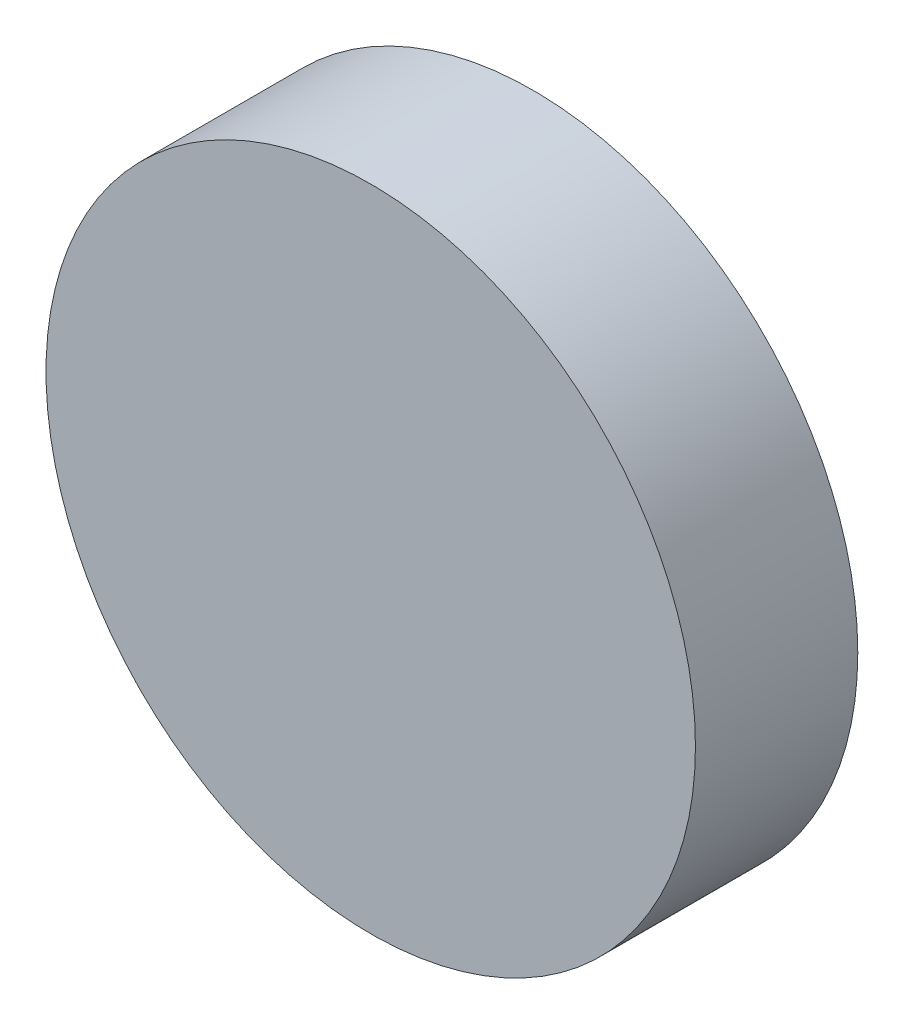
SolidWorks part; units mm, degrees
ref_plane "Plan de face" through (0, 0, 0) normal (0, 0, 1) x (1, 0, 0)
ref_plane "Plan de dessus" through (0, 0, 0) normal (0, 1, 0) x (1, 0, 0)
ref_plane "Plan de droite" through (0, 0, 0) normal (1, 0, 0) x (0, 0, -1)
sketch "Esquisse1" plane through (0, 0, 0) normal (0, 0, 1) x (1, 0, 0)
  circle A0 centre (0, 0) radius 60
extrude "Boss.-Extru.1" add sketch "Esquisse1" along normal blind 30
sketch "Esquisse2" plane through (0, 0, 30) normal (0, 0, 1) x (1, 0, 0)
  circle A0 centre (0, 0) radius 26
extrude "Enlèv. mat.-Extru.1" [suppressed] cut sketch "Esquisse2" against normal blind 8
sketch "Esquisse22" [suppressed] plane through (0, 0, 27) normal (0, 0, 1) x (1, 0, 0)
  line L0 (60, 0) -> (-60, 0) construction
  circle A0 centre (0, 0) radius 60 construction
  point P3 (40, 0)
  point P6 (-40, 0)
  dimension "D1" = 40
  dimension "D2" = 80
hole_wizard "Dégagement M62" positions "Esquisse26" profile "Esquisse25" hole size "M6" standard "ISO"
sketch "Esquisse26" plane through (0, 0, 27) normal (0, 0, 1) x (1, 0, 0)
  point P0 (-40, 0)
  point P1 (40, 0)
sketch "Esquisse25" plane through (-40, 0, 27) normal (1, 0, 0) x (0, -1, 0)
  line L0 (0, 0) -> (0, 28.9828)
  line L1 (0, 28.9828) -> (3.3, 27)
  line L2 (3.3, 27) -> (3.3, 0)
  line L5 (3.3, 0) -> (0, 0)
  line L10 (0, 28.9828) -> (-3.3, 27) construction
  line L11 (0, -6.35) -> (0, 107.95) construction
  dimension "Diamètre du perçage" = 6.6
  dimension "Profondeur du perçage" = 27
  dimension "Angle de pointe" = 118
sketch "Esquisse27" [suppressed] plane through (0, 0, 19) normal (0, 0, 1) x (1, 0, 0)
  line L0 (0, 0) -> (34.8109, 0) construction
  point P3 (19.5, 0)
  dimension "D1" = 19.5
hole_wizard "Diamètre du perçage Ø4.0 (4)2" positions "Esquisse31" profile "Esquisse30" hole size "Ø4.0" standard "ISO"
sketch "Esquisse31" plane through (0, 0, 19) normal (0, 0, 1) x (1, 0, 0)
  point P0 (19.5, 0)
sketch "Esquisse30" plane through (19.5, 0, 19) normal (1, 0, 0) x (0, -1, 0)
  line L0 (0, 0) -> (0, 11.2017)
  line L1 (0, 11.2017) -> (2, 10)
  line L2 (2, 10) -> (2, 0)
  line L5 (2, 0) -> (0, 0)
  line L10 (0, 11.2017) -> (-2, 10) construction
  line L11 (0, -6.35) -> (0, 107.95) construction
  dimension "Diamètre du perçage" = 4
  dimension "Profondeur du perçage" = 10
  dimension "Angle de pointe" = 118
sketch "Esquisse4" [suppressed] plane through (0, 0, 0) normal (0, 0, -1) x (-1, 0, 0)
  line L0 (0, 60) -> (0, -60) construction
  line L1 (60, 0) -> (-60, 0) construction
  line L2 (0, 0) -> (-15.4704, 11.8708) construction
  line L3 (0, 0) -> (11.8708, 15.4704) construction
  line L4 (0, 0) -> (-11.8708, -15.4704) construction
  line L5 (0, 0) -> (15.4704, -11.8708) construction
  circle A0 centre (0, 0) radius 19.5 construction
  circle A1 centre (0, 0) radius 60 construction
  point P10 (-19.5, 0)
  dimension "D1" = 52.5
  dimension "D2" = 90
  dimension "D3" = 90
  dimension "D4" = 90
sketch "Esquisse9" plane through (0, 0, 0) normal (0, 0, -1) x (-1, 0, 0)
  circle A0 centre (0, 0) radius 12.5
extrude "Enlèv. mat.-Extru.4" [suppressed] cut sketch "Esquisse9" against normal through all
hole_wizard "Diamètre du perçage Ø5.3 (5.3)1" positions "Esquisse6" profile "Esquisse5" hole size "Ø5.3" standard "ISO"
sketch "Esquisse6" [suppressed] plane through (0, 0, 0) normal (0, 0, -1) x (-1, 0, 0)
  point P0 (-15.4704, 11.8708)
  point P1 (-11.8708, -15.4704)
  point P4 (15.4704, -11.8708)
  point P7 (11.8708, 15.4704)
sketch "Esquisse5" plane through (15.4704, 11.8708, 0) normal (1, 0, 0) x (0, 1, 0)
  line L0 (0, 0) -> (0, 27)
  line L1 (0, 27) -> (2.65, 27)
  line L2 (2.65, 27) -> (2.65, 0)
  line L5 (2.65, 0) -> (0, 0)
  line L11 (0, -6.35) -> (0, 107.95) construction
  dimension "Diamètre du perçage jusqu'au prochain" = 5.3
  dimension "Profondeur du perçage jusqu'au prochain" = 27
sketch "Esquisse7" [suppressed] plane through (0, 0, 0) normal (0, 0, -1) x (-1, 0, 0)
  circle A0 centre (-15.4704, 11.8708) radius 5
  circle A1 centre (11.8708, 15.4704) radius 5
  circle A2 centre (-11.8708, -15.4704) radius 5
  circle A3 centre (15.4704, -11.8708) radius 5
extrude "Enlèv. mat.-Extru.3" [suppressed] cut sketch "Esquisse7" against normal blind 6.5
sketch "Esquisse11" plane through (0, 0, 0) normal (0, 0, -1) x (-1, 0, 0)
  circle A0 centre (0, 0) radius 60
extrude "Enlèv. mat.-Extru.6" [suppressed] cut sketch "Esquisse11" against normal blind 1.5
sketch "Esquisse12" [suppressed] plane through (0, 0, 1.5) normal (0, 0, -1) x (-1, 0, 0)
  line L0 (-10, 28.0746) -> (-10, 55)
  line L1 (-10, 55) -> (10, 55)
  line L2 (10, 55) -> (10, 28.0746)
  line L3 (-10, -28.0746) -> (-10, -55)
  line L4 (-10, -55) -> (10, -55)
  line L5 (10, -55) -> (10, -28.0746)
  line L6 (60, 0) -> (-60, 0) construction
  line L7 (0, 60) -> (0, -60) construction
  arc A0 (-10, 28.0746) -> (-10, -28.0746) centre (0, 0) ccw
  arc A1 (10, -28.0746) -> (10, 28.0746) centre (0, 0) ccw
  dimension "D1" = 110
  dimension "D2" = 55
  dimension "D3" = 10
  dimension "D4" = 20
  dimension "D5" = 20
extrude "Enlèv. mat.-Extru.7" [suppressed] cut sketch "Esquisse12" against normal through all flip side to cut
fillet "Congé2" [suppressed] radius 6
chamfer "Chanfrein2" [suppressed] distance 15 angle 45
chamfer "Chanfrein3" [suppressed] distance 15 angle 45
sketch "Esquisse14" [suppressed] plane through (0, 19.25, -19.25) normal (0, 0.7071, -0.7071) x (1, 0, 0)
  line L0 (-10, -50.5581) -> (-10, -29.3449) construction
  line L1 (7.5, -57.3449) -> (-7.5, -57.3449)
  line L2 (7.5, -57.3449) -> (7.5, -22.3449)
  line L3 (7.5, -22.3449) -> (-7.5, -22.3449)
  line L4 (-7.5, -57.3449) -> (-7.5, -22.3449)
  line L5 (-10, -29.3449) -> (10, -29.3449) construction
  dimension "D1" = 15
  dimension "D2" = 2.5
  dimension "D3" = 35
  dimension "D4" = 7
extrude "Enlèv. mat.-Extru.9" [suppressed] cut sketch "Esquisse14" against normal blind 3
sketch "Esquisse15" [suppressed] plane through (0, -19.25, -19.25) normal (0, -0.7071, -0.7071) x (1, 0, 0)
  line L0 (10, 29.3449) -> (-10, 29.3449) construction
  line L1 (-7.5, 57.3449) -> (7.5, 57.3449)
  line L2 (-7.5, 57.3449) -> (-7.5, 22.3449)
  line L3 (-7.5, 22.3449) -> (7.5, 22.3449)
  line L4 (7.5, 57.3449) -> (7.5, 22.3449)
  line L5 (10, 50.5581) -> (10, 29.3449) construction
  dimension "D1" = 15
  dimension "D2" = 35
  dimension "D3" = 7
  dimension "D4" = 2.5
extrude "Enlèv. mat.-Extru.10" [suppressed] cut sketch "Esquisse15" against normal blind 3
chamfer "Chanfrein4" [suppressed] distance 15 angle 45
chamfer "Chanfrein5" [suppressed] distance 15 angle 45
hole_wizard "Trou taraudé M101" positions "Esquisse17" profile "Esquisse16" tap size "M10" standard "ISO"
sketch "Esquisse17" [suppressed] plane through (0, -17.1287, -17.1287) normal (0, -0.7071, -0.7071) x (1, 0, 0)
  line L0 (-7.5, 47.3762) -> (-7.5, 26.3449) construction
  line L1 (7.5, 47.3762) -> (-7.5, 47.3762) construction
  point P0 (0, 36.8762)
  dimension "D1" = 7.5
  dimension "D2" = 10.5
sketch "Esquisse16" plane through (0, -43.2041, 8.9467) normal (1, 0, 0) x (0, 0.7071, -0.7071)
  line L0 (0, 0) -> (0, 20.0537)
  line L1 (0, 20.0537) -> (4.25, 17.5)
  line L2 (4.25, 17.5) -> (4.25, 0)
  line L5 (4.25, 0) -> (0, 0)
  line L10 (0, 20.0537) -> (-4.25, 17.5) construction
  line L11 (0, -6.35) -> (0, 107.95) construction
  dimension "Diamètre du trou pour taraudage" = 8.5
  dimension "Profondeur du trou pour taraudage" = 17.5
  dimension "Angle de pointe" = 118
hole_wizard "Trou taraudé M102" positions "Esquisse19" profile "Esquisse18" tap size "M10" standard "ISO"
sketch "Esquisse19" [suppressed] plane through (0, 17.1287, -17.1287) normal (0, 0.7071, -0.7071) x (-1, 0, 0)
  line L0 (7.5, 47.3762) -> (-7.5, 47.3762) construction
  line L1 (7.5, 26.3449) -> (7.5, 47.3762) construction
  point P0 (0, 36.8762)
  dimension "D1" = 10.5
  dimension "D2" = 7.5
sketch "Esquisse18" [suppressed] plane through (0, 43.2041, 8.9467) normal (1, 0, 0) x (0, 0.7071, 0.7071)
  line L0 (0, 0) -> (0, 20.0537)
  line L1 (0, 20.0537) -> (4.25, 17.5)
  line L2 (4.25, 17.5) -> (4.25, 0)
  line L5 (4.25, 0) -> (0, 0)
  line L10 (0, 20.0537) -> (-4.25, 17.5) construction
  line L11 (0, -6.35) -> (0, 107.95) construction
  dimension "Diamètre du trou pour taraudage" = 8.5
  dimension "Profondeur du trou pour taraudage" = 17.5
  dimension "Angle de pointe" = 118
chamfer "Chanfrein6" [suppressed] distance 0.5 angle 45
